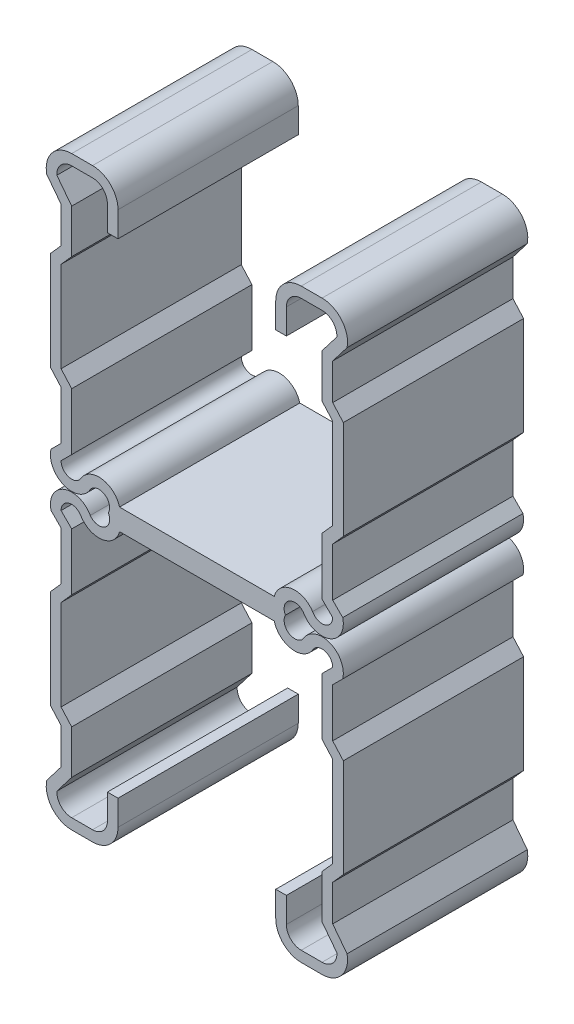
SolidWorks part; units mm, degrees
ref_plane "Plane1" through (0, 0, 0) normal (0, 0, 1) x (1, 0, 0)
ref_plane "Plane2" through (0, 0, 0) normal (0, 1, 0) x (1, 0, 0)
ref_plane "Plane3" through (0, 0, 0) normal (1, 0, 0) x (0, 0, -1)
other "Configuration Table"
sketch "Sketch1" plane through (0, 0, 0) normal (0, 0, 1) x (1, 0, 0)
  line L0 (17.6403, 16.3393) -> (19.7299, 19.0635)
  line L1 (17.6403, -13.9795) -> (19.1389, -15.4781)
  line L2 (-17.6403, -13.9795) -> (-19.1389, -15.4781)
  line L4 (-17.6403, -13.9795) -> (-17.6403, -5.9368)
  line L5 (17.6403, 21.2598) -> (14.7033, 21.2598)
  line L6 (12.6111, 19.1676) -> (12.6111, 15.6147)
  line L7 (-17.6403, -5.9368) -> (-19.1389, -4.2539)
  line L8 (-12.6111, 19.1676) -> (-12.6111, 15.6147)
  line L9 (0, 10.16) -> (0, -7.62) construction
  line L10 (-19.1389, -4.2539) -> (-19.1389, 8.4957)
  line L11 (-17.6403, 10.1786) -> (-19.1389, 8.4957)
  line L12 (-17.6403, 10.1786) -> (-17.6403, 16.3393)
  line L13 (-17.6403, 16.3393) -> (-19.7299, 19.0635)
  line L14 (-17.6403, 21.2598) -> (-14.7033, 21.2598)
  line L16 (17.6403, -13.9795) -> (17.6403, -5.9368)
  line L17 (17.6403, 10.1786) -> (17.6403, 16.3393)
  line L18 (-11.1125, 19.1676) -> (-11.1125, 15.6147)
  line L19 (-17.6403, 22.7584) -> (-14.7033, 22.7584)
  line L20 (-19.1389, 15.8307) -> (-21.1624, 18.4689)
  line L21 (-19.1389, 10.7491) -> (-19.1389, 15.8307)
  line L22 (-19.1389, 10.7491) -> (-20.6375, 9.0662)
  line L23 (-20.6375, -4.8244) -> (-20.6375, 9.0662)
  line L24 (-19.1389, -6.5073) -> (-20.6375, -4.8244)
  line L25 (19.1389, -4.2539) -> (19.1389, 8.4957)
  line L26 (-19.1389, -13.3588) -> (-19.1389, -6.5073)
  line L27 (-19.1389, -13.3588) -> (-20.5535, -14.7733)
  line L28 (11.1125, 19.1676) -> (11.1125, 15.6147)
  line L29 (17.6403, 22.7584) -> (14.7033, 22.7584)
  line L30 (19.1389, 15.8307) -> (21.1624, 18.4689)
  line L31 (19.1389, 10.7491) -> (19.1389, 15.8307)
  line L32 (19.1389, 10.7491) -> (20.6375, 9.0662)
  line L33 (20.6375, -4.8244) -> (20.6375, 9.0662)
  line L34 (19.1389, -6.5073) -> (20.6375, -4.8244)
  line L35 (19.1389, -13.3588) -> (19.1389, -6.5073)
  line L36 (19.1389, -13.3588) -> (20.5535, -14.7733)
  line L37 (17.6403, -5.9368) -> (19.1389, -4.2539)
  line L38 (-12.4806, -18.5166) -> (12.4806, -18.5166)
  line L39 (17.6403, 10.1786) -> (19.1389, 8.4957)
  line L41 (-10.899, -17.018) -> (10.899, -17.018)
  line L42 (-12.6111, 15.6147) -> (-11.1125, 15.6147)
  line L43 (11.1125, 15.6147) -> (12.6111, 15.6147)
  arc A0 (19.1389, -15.4781) -> (16.3052, -16.1588) centre (17.6403, -15.4781) cw
  arc A1 (16.3052, -16.1588) -> (10.899, -17.018) centre (13.7938, -17.7947) ccw
  arc A2 (-16.4143, -16.3399) -> (-10.899, -17.018) centre (-13.7938, -17.7947) cw
  arc A3 (-19.1389, -15.4781) -> (-16.4143, -16.3399) centre (-17.6403, -15.4781) ccw
  arc A4 (-17.6403, 21.2598) -> (-19.7299, 19.0635) centre (-17.6403, 19.1676) ccw
  arc A5 (-12.6111, 19.1676) -> (-14.7033, 21.2598) centre (-14.7033, 19.1676) ccw
  arc A6 (17.6403, 21.2598) -> (19.7299, 19.0635) centre (17.6403, 19.1676) cw
  arc A7 (12.6111, 19.1676) -> (14.7033, 21.2598) centre (14.7033, 19.1676) cw
  arc A8 (-11.1125, 19.1676) -> (-14.7033, 22.7584) centre (-14.7033, 19.1676) ccw
  arc A9 (-17.6403, 22.7584) -> (-21.1624, 18.4689) centre (-17.6403, 19.1676) ccw
  arc A10 (-20.5535, -14.7733) -> (-15.0198, -16.9329) centre (-17.6403, -15.4781) ccw
  arc A11 (11.1125, 19.1676) -> (14.7033, 22.7584) centre (14.7033, 19.1676) cw
  arc A12 (17.6403, 22.7584) -> (21.1624, 18.4689) centre (17.6403, 19.1676) cw
  arc A13 (20.5535, -14.7733) -> (15.0198, -16.9329) centre (17.6403, -15.4781) cw
  arc A14 (15.0198, -16.9329) -> (12.4806, -18.5166) centre (13.7938, -17.7947) ccw
  arc A15 (-15.0198, -16.9329) -> (-12.4806, -18.5166) centre (-13.7938, -17.7947) cw
  dimension "D9" = 7.1437
  dimension "base" = 18.5166
  dimension "D5" = 9.525
  dimension "ToeHt" = 22.7584
  dimension "D6" = 22.225
  dimension "D8" = 15.4781
  dimension "D12" = 41.275
  dimension "D14" = 13.6922
  dimension "D15" = 13.8906
extrude "Base-Extrude" add sketch "Sketch1" along normal mid plane 25.4
ref_plane "Plane4" through (0, -18.5166, 0) normal (0, -1, 0) x (1, 0, 0)
mirror "Mirror1" about plane through (0, -18.5166, 0) normal (0, -1, 0) of "Base-Extrude"
